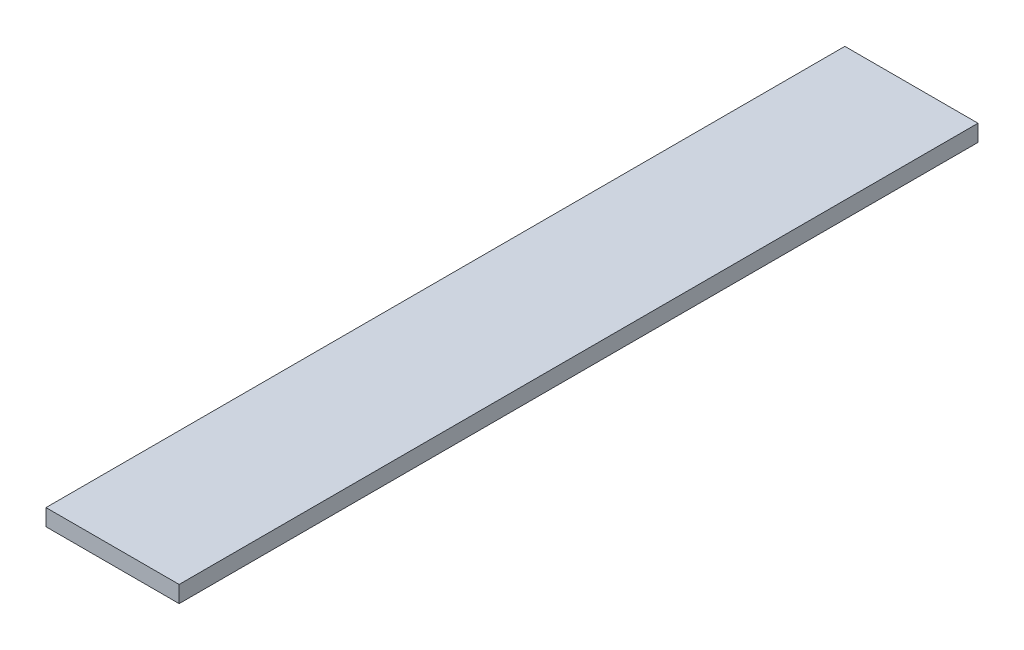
SolidWorks part; units mm, degrees
ref_plane "Plane1" through (0, 0, 0) normal (0, 0, 1) x (1, 0, 0)
ref_plane "Plane2" through (0, 0, 0) normal (0, 1, 0) x (1, 0, 0)
ref_plane "Plane3" through (0, 0, 0) normal (1, 0, 0) x (0, 0, -1)
sketch "Sketch1" plane through (0, 0, 0) normal (0, 0, 1) x (1, 0, 0)
  line L1 (0, 0) -> (50.8, 0)
  line L2 (0, 0) -> (0, 6.35)
  line L3 (0, 6.35) -> (50.8, 6.35)
  line L4 (50.8, 0) -> (50.8, 6.35)
  dimension "D1" = 50.8
  dimension "D2" = 6.35
extrude "Base-Extrude" add sketch "Sketch1" along normal blind 304.8
